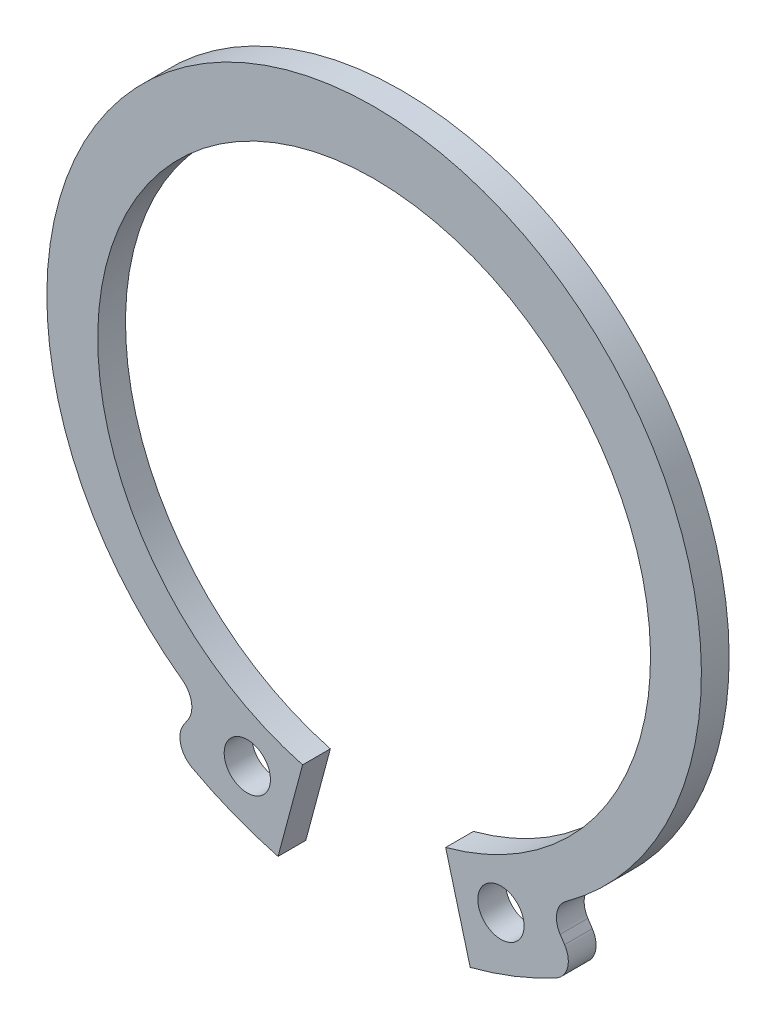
SolidWorks part; units mm, degrees
ref_plane "Plan1" through (0, 0, 0) normal (0, 0, 1) x (1, 0, 0)
ref_plane "Plan2" through (0, 0, 0) normal (0, 1, 0) x (1, 0, 0)
ref_plane "Plan3" through (0, 0, 0) normal (1, 0, 0) x (0, 0, -1)
sketch "Esquisse1" plane through (0, 0, 0) normal (0, 0, 1) x (1, 0, 0)
  line L0 (0, 0) -> (4.154, -15.5031) construction
  line L1 (0, 0) -> (0, -67.082) construction
  line L2 (8.0434, -12.3208) -> (8.234, -12.6127)
  line L3 (3.0929, -11.5428) -> (4.154, -15.5031)
  line L4 (-3.0929, -11.5428) -> (-4.154, -15.5031)
  line L5 (-8.0434, -12.3208) -> (-8.234, -12.6127)
  line L6 (3.0929, -11.5428) -> (7.8728, -14.0387) construction
  line L7 (0, 0) -> (0, 11.95) construction
  line L8 (0, 11.95) -> (0, 14.65) construction
  arc A0 (3.0929, -11.5428) -> (-3.0929, -11.5428) centre (0, 0) ccw
  arc A1 (4.154, -15.5031) -> (7.8728, -14.0387) centre (0, 0.5) ccw
  arc A2 (8.2946, -10.964) -> (-8.2946, -10.964) centre (0, 0.5) ccw
  arc A3 (-7.8728, -14.0387) -> (-4.154, -15.5031) centre (0, 0.5) ccw
  arc A4 (-8.2946, -10.964) -> (-8.0434, -12.3208) centre (-8.8807, -11.7742) cw
  arc A5 (8.2946, -10.964) -> (8.0434, -12.3208) centre (8.8807, -11.7742) ccw
  circle A6 centre (5.4828, -12.7908) radius 1
  circle A7 centre (-5.4828, -12.7908) radius 1
  arc A8 (-7.8728, -14.0387) -> (-8.234, -12.6127) centre (-7.3966, -13.1594) cw
  arc A9 (7.8728, -14.0387) -> (8.234, -12.6127) centre (7.3966, -13.1594) ccw
  point P22 (-8.808, -13.492)
  dimension "D1" = 23.9
  dimension "D2" = 4.1
  dimension "D3" = 2.7
  dimension "D8" = 2
  dimension "D4" = 0.5
  dimension "D5" = 5
extrude "Base-Extrusion" add sketch "Esquisse1" along normal blind 1.2
equation "\"R@Esquisse1\" = \"D8@Esquisse1\"/2"
equation "\"D4@Esquisse1\"=\"R@Esquisse1\"/2"
equation "\"D5@Esquisse1\"=\"D8@Esquisse1\"*2.5"
